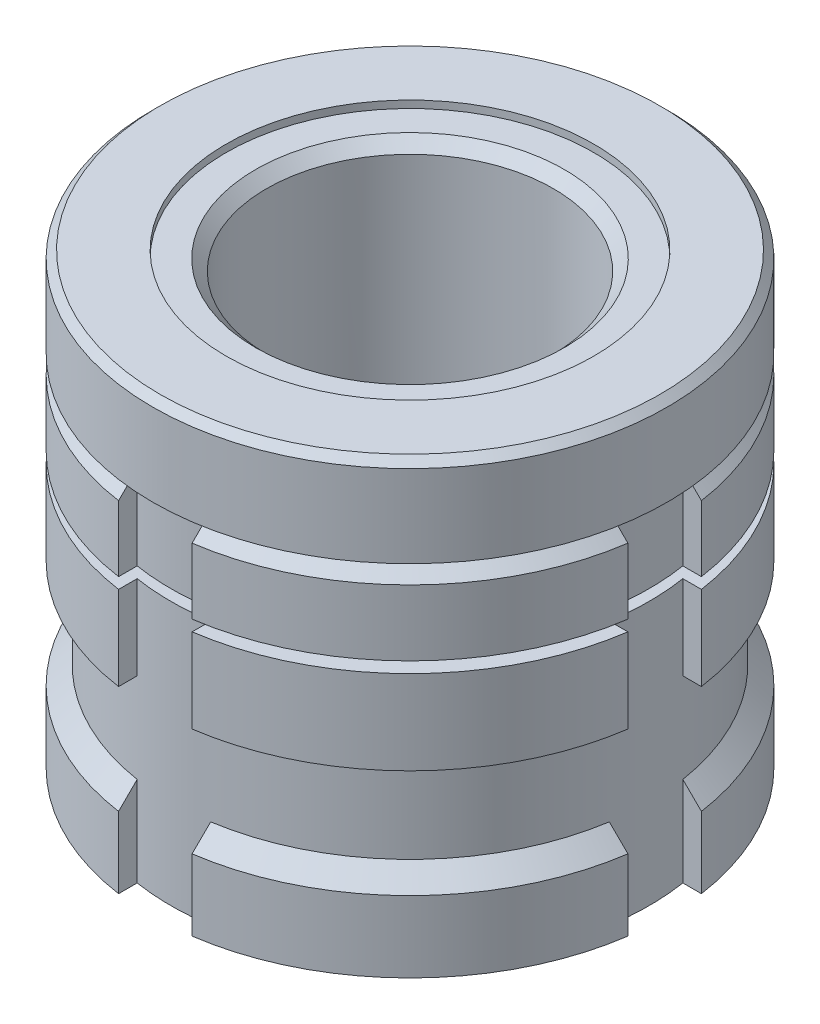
SolidWorks part; units mm, degrees
ref_plane "Front Plane" through (0, 0, 0) normal (0, 0, 1) x (1, 0, 0)
ref_plane "Top Plane" through (0, 0, 0) normal (0, 1, 0) x (1, 0, 0)
ref_plane "Right Plane" through (0, 0, 0) normal (1, 0, 0) x (0, 0, -1)
sketch "Sketch1" plane through (0, 0, 0) normal (0, 1, 0) x (1, 0, 0)
  circle A0 centre (0, 0) radius 35
  dimension "D1" = 70
extrude "Boss-Extrude1" add sketch "Sketch1" along normal blind 24.4
sketch "Sketch2" plane through (0, 0, 0) normal (1, 0, 0) x (0, 0, -1)
  line L0 (0, 13.2648) -> (0, -2.3994) construction
  line L1 (-35, 0) -> (35, 0) construction
  line L2 (-35, 12.95) -> (-25, 12.95)
  line L3 (-35, 12.95) -> (-35, 11.45)
  line L4 (-35, 11.45) -> (-25, 11.45)
  line L5 (-25, 12.95) -> (-25, 11.45)
  line L6 (-35, 12.95) -> (-25, 11.45) construction
  line L7 (-35, 11.45) -> (-25, 12.95) construction
  point P3 (-30, 12.2)
  point P8 (-35, 12.2)
  dimension "D1" = 1.5
  dimension "D2" = 35
  dimension "D3" = 25
  dimension "D4" = 12.2
revolve "Cut-Revolve1" cut sketch "Sketch2" angle 360 about L0
sketch "Sketch3" plane through (0, 0, 0) normal (0, -1, 0) x (1, 0, 0)
  circle A0 centre (0, 0) radius 32.5
  dimension "D1" = 65
extrude "Boss-Extrude2" add sketch "Sketch3" along normal blind 24.4
sketch "Sketch4" plane through (0, -24.4, 0) normal (0, -1, 0) x (1, 0, 0)
  circle A0 centre (0, 0) radius 35
  circle A1 centre (0, 0) radius 35 construction
extrude "Boss-Extrude3" add sketch "Sketch4" against normal blind 12.2
sketch "Sketch5" plane through (0, 24.4, 0) normal (0, 1, 0) x (1, 0, 0)
  line L0 (-34.641, 5) -> (-32.1131, 5)
  line L2 (-32.1131, -5) -> (-34.641, -5)
  line L3 (-5, 34.641) -> (-5, 32.1131)
  line L5 (5, 32.1131) -> (5, 34.641)
  line L6 (32.1131, 5) -> (34.641, 5)
  line L8 (34.641, -5) -> (32.1131, -5)
  line L9 (-5, -32.1131) -> (-5, -34.641)
  line L11 (5, -34.641) -> (5, -32.1131)
  arc A0 (-32.1131, 5) -> (-32.1131, -5) centre (0, 0) ccw
  circle A1 centre (0, 0) radius 32.5 construction
  arc A2 (-34.641, 5) -> (-34.641, -5) centre (0, 0) ccw
  circle A3 centre (0, 0) radius 35 construction
  arc A4 (-5, -32.1131) -> (5, -32.1131) centre (0, 0) ccw
  arc A5 (-5, -34.641) -> (5, -34.641) centre (0, 0) ccw
  arc A6 (32.1131, -5) -> (32.1131, 5) centre (0, 0) ccw
  arc A7 (34.641, -5) -> (34.641, 5) centre (0, 0) ccw
  arc A8 (5, 32.1131) -> (-5, 32.1131) centre (0, 0) ccw
  arc A9 (5, 34.641) -> (-5, 34.641) centre (0, 0) ccw
  point P1 (-35, 0)
  point P5 (-32.5, 0)
  point P25 (0, 0)
  dimension "D1" = 10
extrude "Cut-Extrude4" cut sketch "Sketch5" against normal up to surface (48.8 mm away)
chamfer "Chamfer1" distance 2.5 angle 45 8 edges at (-24.7487, -12.2, -24.7487) (24.7487, -12.2, -24.7487) (-24.7487, 24.4, -24.7487) (24.7487, 24.4, -24.7487) (24.7487, 24.4, 24.7487) (24.7487, -12.2, 24.7487) (-24.7487, -12.2, 24.7487) (-24.7487, 24.4, 24.7487)
sketch "Sketch6" plane through (0, 24.4, 0) normal (0, 1, 0) x (1, 0, 0)
  circle A0 centre (0, 0) radius 35
  arc A1 (5, -34.641) -> (34.641, -5) centre (0, 0) ccw construction
extrude "Boss-Extrude4" add sketch "Sketch6" along normal blind 12.2
chamfer "Chamfer2" distance 1 angle 45 1 edges at (0, 36.6, 35)
sketch "Sketch7" plane through (0, 36.6, 0) normal (0, 1, 0) x (1, 0, 0)
  circle A0 centre (0, 0) radius 25
  dimension "D1" = 50
extrude "Cut-Extrude5" cut sketch "Sketch7" against normal blind 1
sketch "Sketch8" plane through (0, 35.6, 0) normal (0, 1, 0) x (1, 0, 0)
  circle A0 centre (0, 0) radius 19.5
  dimension "D1" = 39
extrude "Cut-Extrude6" cut sketch "Sketch8" against normal up to surface (60 mm away)
chamfer "Chamfer3" distance 1.5 angle 45 2 edges at (0, -24.4, -19.5) (0, 35.6, 19.5)
